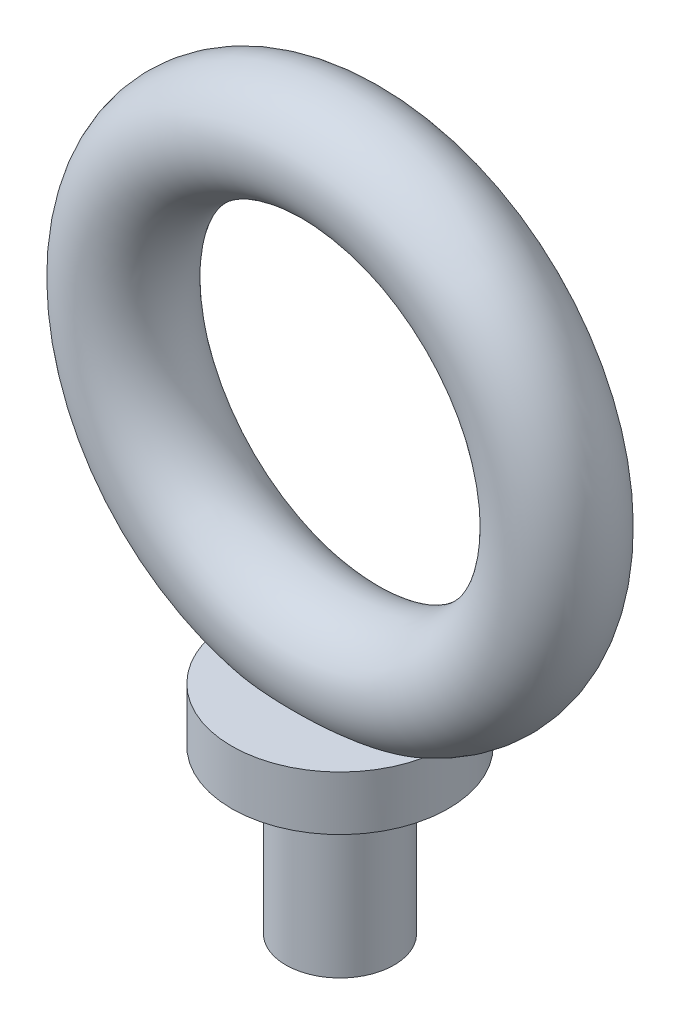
SolidWorks part; units mm, degrees
ref_plane "Front" through (0, 0, 0) normal (0, 0, 1) x (1, 0, 0)
ref_plane "Top" through (0, 0, 0) normal (0, 1, 0) x (1, 0, 0)
ref_plane "Right" through (0, 0, 0) normal (1, 0, 0) x (0, 0, -1)
sketch "Sketch1" plane through (0, 0, 0) normal (0, 1, 0) x (1, 0, 0)
  circle A0 centre (0, 0) radius 6.35
  dimension "D1" = 12.7
extrude "Extrude1" add sketch "Sketch1" along normal blind 25.4
sketch "Sketch2" plane through (0, 25.4, 0) normal (0, 1, 0) x (-1, 0, 0)
  circle A0 centre (0, 0) radius 12.7
  dimension "D1" = 25.4
extrude "Extrude2" add sketch "Sketch2" against normal blind 6.35
sketch "Sketch3" plane through (0, 0, 0) normal (1, 0, 0) x (0, 0, -1)
  line L0 (-68.58, 25.4) -> (73.66, 25.4) construction
  line L2 (0, 171.337) -> (0, -15.0138) construction
  line L3 (0, 19.05) -> (0, 0) construction
  line L4 (6.35, 25.4) -> (-6.35, 25.4) construction
  circle A0 centre (0, 28.575) radius 6.35
  dimension "D1" = 12.7
  dimension "D2" = 3.175
ref_plane "Plane1" through (0, 38.1, 0) normal (0, -1, 0) x (1, 0, 0)
sketch "Sketch7" plane through (0, 0, 0) normal (0, 0, 1) x (1, 0, 0)
  circle A0 centre (0, 53.975) radius 25.4
  dimension "D1" = 50.8
sweep "Sweep2" add profiles "Sketch3" path "Sketch7"
sketch "Sketch8" plane through (0, 0, 0) normal (0, 0, 1) x (1, 0, 0)
  line L0 (0, 101.6) -> (15.3977, 101.6)
  line L1 (0, 19.05) -> (0, 25.4) construction
  line L2 (0, 101.6) -> (0, 91.4421)
  dimension "D1" = 101.6
sketch "Sketch9" plane through (0, 0, 0) normal (1, 0, 0) x (0, 0, -1)
  line L0 (0, 50.8) -> (0, 88.9)
  line L1 (0, 50.8) -> (22.86, 50.8)
  line L2 (12.7, 25.4) -> (2.6844, 25.4) construction
  dimension "D1" = 25.4
